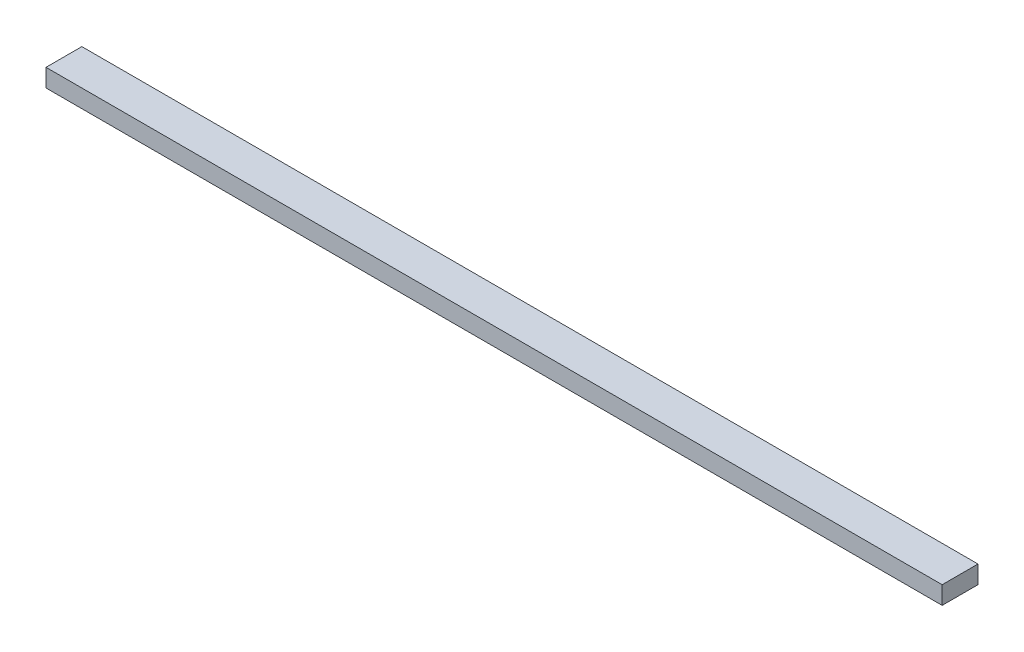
SolidWorks part; units mm, degrees
ref_plane "Face" through (0, 0, 0) normal (0, 0, 1) x (1, 0, 0)
ref_plane "Dessus" through (0, 0, 0) normal (0, 1, 0) x (1, 0, 0)
ref_plane "Droite" through (0, 0, 0) normal (1, 0, 0) x (0, 0, -1)
sketch "Esquisse1" plane through (0, 0, 0) normal (0, 1, 0) x (1, 0, 0)
  line L1 (0, 0) -> (250, 0)
  line L2 (0, 0) -> (0, 10)
  line L3 (0, 10) -> (250, 10)
  line L4 (250, 0) -> (250, 10)
  dimension "D1" = 250
  dimension "D2" = 10
extrude "Extrusion1" add sketch "Esquisse1" along normal blind 5
